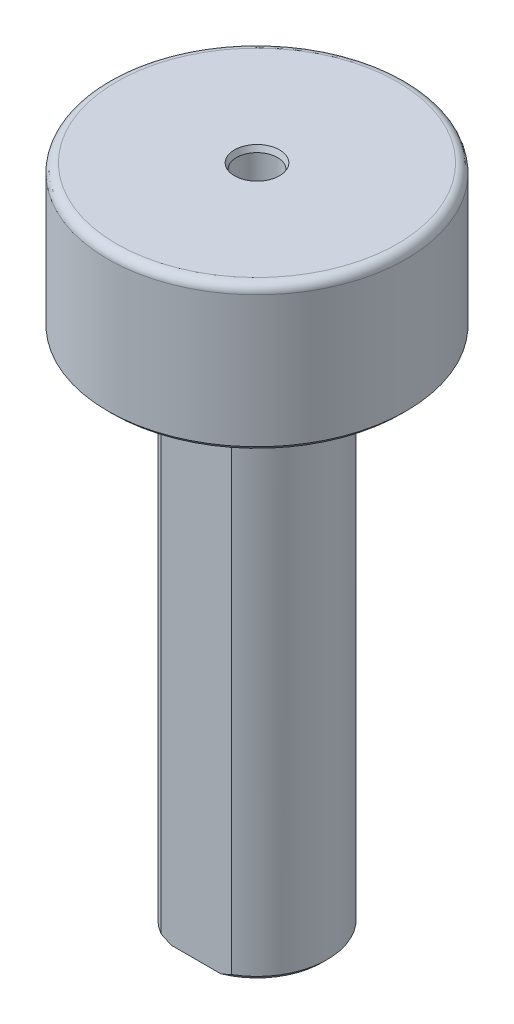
SolidWorks part; units mm, degrees
ref_plane "FRONT" through (0, 0, 0) normal (0, 0, 1) x (1, 0, 0)
ref_plane "TOP" through (0, 0, 0) normal (0, 1, 0) x (1, 0, 0)
ref_plane "RT-SIDE" through (0, 0, 0) normal (1, 0, 0) x (0, 0, -1)
sketch "Sketch1" plane through (0, 0, 0) normal (0, 0, 1) x (1, 0, 0)
  line L0 (0, 0) -> (0, -99.6613) construction
  line L1 (0, 0) -> (38.1254, 0)
  line L2 (40.513, -2.3876) -> (40.513, -39.37)
  line L3 (40.513, -39.37) -> (32.893, -39.37)
  line L4 (32.893, -39.37) -> (32.893, -6.35)
  line L5 (32.893, -6.35) -> (19.05, -6.35)
  line L6 (19.05, -6.35) -> (19.05, -179.07)
  line L7 (0, 0) -> (0, -179.07)
  line L8 (0, -179.07) -> (19.05, -179.07)
  arc A0 (40.513, -2.3876) -> (38.1254, 0) centre (38.1254, -2.3876) ccw
  point P14 (40.513, 0)
  dimension "D9" = 2.3876
  dimension "D1" = 39.37
  dimension "D2" = 40.513
  dimension "D3" = 7.62
  dimension "D4" = 6.35
  dimension "D5" = 19.05
  dimension "D6" = 179.07
revolve "Base-Revolve" add sketch "Sketch1" angle 360 about L0
ref_plane "Plane4" through (0, 0, 0) normal (-1, 0, 0) x (0, 0, 1)
chamfer "Chamfer1" distance 1.27 angle 45
sketch "Sketch4" plane through (0, 0, 0) normal (0, 1, 0) x (-1, 0, 0)
  circle A0 centre (0, 0) radius 5.5562
  dimension "D1" = 11.1125
extrude "Cut-Extrude1" cut sketch "Sketch4" against normal blind 19.05
chamfer "Chamfer2" distance 1.524 angle 20
sketch "Sketch6" plane through (0, -179.07, 0) normal (0, -1, 0) x (1, 0, 0)
  line L2 (0, 0) -> (0, -31.5183) construction
  line L3 (9.525, 16.4978) -> (-9.525, 16.4978)
  circle A0 centre (0, 0) radius 19.05 construction
  arc A1 (9.525, 16.4978) -> (-9.525, 16.4978) centre (0, 0) ccw
  dimension "D2" = 19.05
  dimension "D1" = 16.4978
extrude "Cut-Extrude2" cut sketch "Sketch6" against normal blind 127
